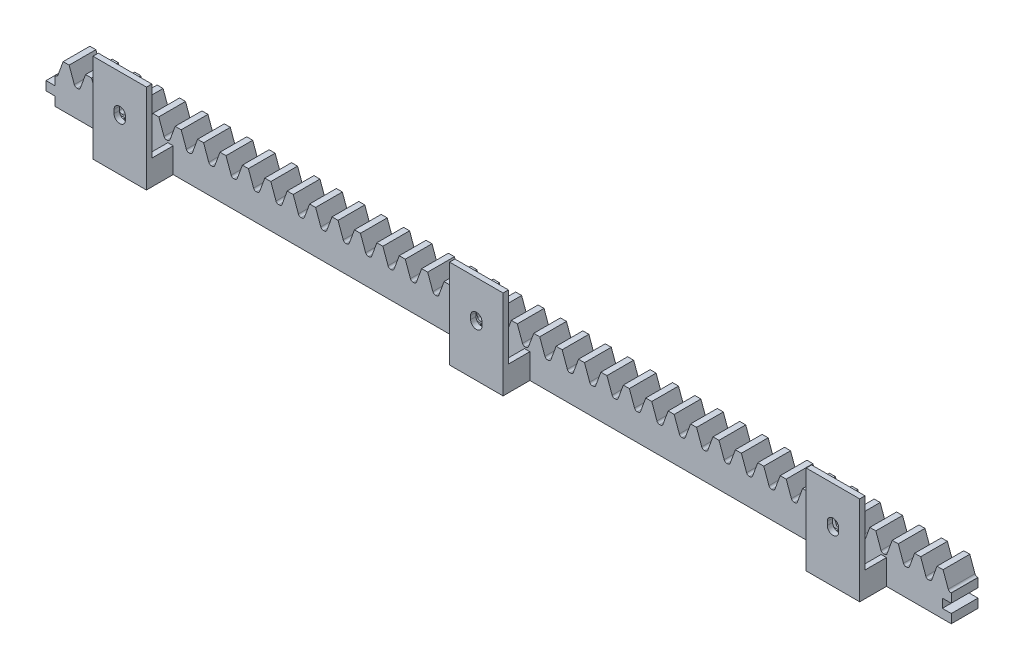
SolidWorks part; units mm, degrees
ref_plane "Plan median" through (0, 0, 0) normal (0, 0, 1) x (1, 0, 0)
ref_plane "Plan2" through (0, 0, 0) normal (0, 1, 0) x (1, 0, 0)
ref_plane "Plan3" through (0, 0, 0) normal (1, 0, 0) x (0, 0, -1)
sketch "Esquisse1" plane through (0, 0, 0) normal (0, 0, 1) x (1, 0, 0)
  line L0 (0, 0) -> (6.2832, 0) construction
  line L1 (1.4556, 4) -> (-1.4555, -3.9998)
  line L2 (1.4556, 4) -> (4.8276, 4)
  line L3 (4.8276, 4) -> (7.7387, -3.9998)
  line L4 (0, 0) -> (0, 4) construction
  line L5 (9.1671, -5) -> (9.4248, -5)
  line L6 (-2.8839, -5) -> (-3.1416, -5)
  line L7 (9.4248, -5) -> (9.4248, 7.1416)
  line L8 (-3.1416, -5) -> (-3.1416, 7.1416)
  line L9 (-3.1416, 7.1416) -> (9.4248, 7.1416)
  arc A0 (7.7387, -3.9998) -> (9.1671, -5) centre (9.1671, -3.48) ccw
  arc A1 (-2.8839, -5) -> (-1.4555, -3.9998) centre (-2.8839, -3.48) ccw
  point P14 (-1.8195, -5)
ref_plane "Plan4" through (-3.1416, 0, 0) normal (1, 0, 0) x (0, 0, -1)
sketch "Section Cremaillere" plane through (-3.1416, 0, 0) normal (1, 0, 0) x (0, 0, -1)
  line L1 (-7.5, 7.1416) -> (7.5, 7.1416)
  line L2 (-7.5, 7.1416) -> (-7.5, -20)
  line L3 (-7.5, -20) -> (7.5, -20)
  line L4 (7.5, 7.1416) -> (7.5, -20)
  line L5 (0, -20) -> (0, 7.1416) construction
  line L6 (0, 50) -> (0, -50) construction
  dimension "L" = 15
  dimension "h" = 20
extrude "Base-Extrusion" add sketch "Section Cremaillere" along normal blind 502.6548
extrude "Enlèv. mat.-Extru.2" cut sketch "Esquisse1" against normal through all and the other way blind 100
pattern_linear "Répétition linéaire1" count 40 spacing 12.5664 along (1, 0, 0) of "Enlèv. mat.-Extru.2"
sketch "Esquisse2" plane through (-3.1416, 0, 0) normal (-1, 0, 0) x (0, 0, 1)
  line L0 (0, 0) -> (-7.5, 0)
  line L1 (0, 0) -> (7.5, 0)
  line L2 (-7.5, -5) -> (7.5, -5) construction
  line L3 (-7.5, -5) -> (7.5, -5)
  line L4 (-7.5, 7.1416) -> (-7.5, -20) construction
  line L5 (7.5, 7.1416) -> (7.5, -20) construction
  line L6 (-7.5, 0) -> (-7.5, -5)
  line L7 (7.5, 0) -> (7.5, -5)
extrude "Plan primitif" [suppressed] add sketch "Esquisse2" along normal up to surface (188.4956 mm away)
sketch "Esquisse3" plane through (0, 0, 0) normal (0, 0, 1) x (1, 0, 0)
  line L0 (-2.8839, 0) -> (499.2555, 0) construction
  line L1 (0, 0) -> (6.2832, 0) construction
ref_plane "Plan milieu" through (248.1858, 0, 0) normal (-1, 0, 0) x (0, 0, 1)
sketch "Esquisse4" plane through (0, -20, 0) normal (0, -1, 0) x (1, 0, 0)
  line L0 (248.1858, 0) -> (248.1858, 93.6811) construction
  line L1 (-2.8839, 0) -> (499.2555, 0) construction
  line L2 (499.5132, 7.5) -> (-3.1416, 7.5) construction
  line L3 (233.1858, 7.5) -> (236.1858, 7.5)
  line L4 (233.1858, 7.5) -> (233.1858, 19.5)
  line L5 (233.1858, 19.5) -> (236.1858, 19.5)
  line L6 (236.1858, 7.5) -> (236.1858, 19.5)
  line L7 (260.1858, 7.5) -> (260.1858, 19.5)
  line L8 (263.1858, 19.5) -> (260.1858, 19.5)
  line L9 (263.1858, 7.5) -> (263.1858, 19.5)
  line L10 (263.1858, 7.5) -> (260.1858, 7.5)
  dimension "D1" = 12
  dimension "D2" = 3
  dimension "D3" = 15
extrude "Boss.-Extru.1" add sketch "Esquisse4" against normal blind 14
sketch "Esquisse5" plane through (0, 0, 19.5) normal (0, 0, 1) x (1, 0, 0)
  line L0 (233.1858, -6) -> (233.1858, -20) construction
  line L1 (263.1858, -20) -> (233.1858, -20)
  line L2 (263.1858, -20) -> (263.1858, 30)
  line L3 (263.1858, 30) -> (233.1858, 30)
  line L4 (233.1858, -20) -> (233.1858, 30)
  dimension "D1" = 50
extrude "Boss.-Extru.2" add sketch "Esquisse5" along normal blind 3
sketch "Esquisse7" plane through (0, 0, 22.5) normal (0, 0, 1) x (1, 0, 0)
  line L0 (248.1858, -20) -> (248.1858, 74.4449) construction
  line L1 (233.1858, -20) -> (263.1858, -20) construction
  line L3 (269.7315, 8) -> (225.8421, 8) construction
  line L4 (-2.8839, 0) -> (499.2555, 0) construction
  line L5 (248.1858, 8) -> (248.1858, 10) construction
  line L6 (244.9858, 8) -> (244.9858, 10)
  line L7 (251.3858, 8) -> (251.3858, 10)
  line L8 (248.1858, 8) -> (241.6189, 8) construction
  arc A1 (244.9858, 8) -> (251.3858, 8) centre (248.1858, 8) ccw
  arc A2 (251.3858, 10) -> (244.9858, 10) centre (248.1858, 10) ccw
  point P10 (248.1858, 9)
  dimension "D1" = 8
  dimension "D2" = 3.2
  dimension "D3" = 2
extrude "Enlèv. mat.-Extru.3" cut sketch "Esquisse7" against normal through all
pattern_linear "Répétition linéaire2" count 2 spacing 200 along (1, 0, 0) count 2 spacing 200 along (-1, 0, 0) of "Boss.-Extru.2", "Boss.-Extru.1", "Enlèv. mat.-Extru.3"
sketch "Esquisse8" plane through (0, 0, -7.5) normal (0, 0, -1) x (-1, 0, 0)
  line L0 (3.1416, -12.5) -> (16.1689, -12.5) construction
  line L1 (3.1416, -20) -> (3.1416, -5) construction
  line L3 (8.1416, -10) -> (3.1416, -10)
  line L4 (8.1416, -10) -> (8.1416, -15)
  line L5 (8.1416, -15) -> (3.1416, -15)
  line L6 (3.1416, -10) -> (3.1416, -15)
  line L7 (8.1416, -10) -> (3.1416, -15) construction
  line L8 (8.1416, -15) -> (3.1416, -10) construction
  point P4 (5.6416, -12.5)
  dimension "D1" = 5
  dimension "D2" = 5
extrude "Boss.-Extru.3" add sketch "Esquisse8" against normal up to surface (15 mm away)
sketch "Esquisse9" plane through (0, 0, -7.5) normal (0, 0, -1) x (-1, 0, 0)
  line L0 (-499.5132, -12.5) -> (-484.4926, -12.5) construction
  line L1 (-499.5132, -20) -> (-499.5132, -5) construction
  line L3 (-494.5132, -10) -> (-499.5132, -10)
  line L4 (-494.5132, -10) -> (-494.5132, -15)
  line L5 (-494.5132, -15) -> (-499.5132, -15)
  line L6 (-499.5132, -10) -> (-499.5132, -15)
  line L7 (-494.5132, -10) -> (-499.5132, -15) construction
  line L8 (-494.5132, -15) -> (-499.5132, -10) construction
  point P4 (-497.0132, -12.5)
  dimension "D1" = 5
  dimension "D2" = 5
extrude "Enlèv. mat.-Extru.4" cut sketch "Esquisse9" against normal through all
equation "\"LD@Esquisse1\" = \"m@Esquisse1\"*1.570796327"
equation "\"FD@Esquisse1\"=\"m@Esquisse1\"*1.25"
equation "\"DLD@Esquisse1\"=\"LD@Esquisse1\"/2"
equation "\"R1@Esquisse1\"=\"m@Esquisse1\"*0.38"
equation "\"D1@Base-Extrusion\"=\"LD@Esquisse1\"*2*\"Nd@Répétition linéaire1\""
equation "\"D3@Répétition linéaire1\"=\"LD@Esquisse1\"*2"
